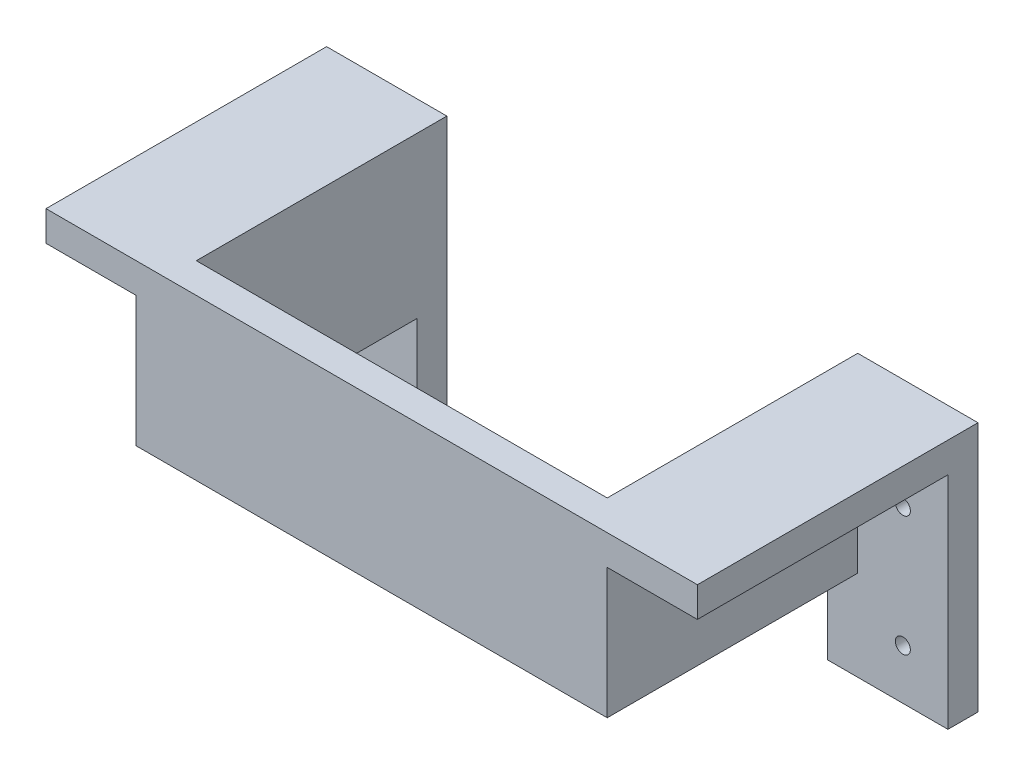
SolidWorks part; units mm, degrees
ref_plane "Plan de face" through (0, 0, 0) normal (0, 0, 1) x (1, 0, 0)
ref_plane "Plan de dessus" through (0, 0, 0) normal (0, 1, 0) x (1, 0, 0)
ref_plane "Plan de droite" through (0, 0, 0) normal (1, 0, 0) x (0, 0, -1)
sketch "Esquisse1" plane through (0, 0, 0) normal (0, 0, 1) x (1, 0, 0)
  line L1 (0, 0) -> (-65, 0)
  line L2 (0, 0) -> (0, -25)
  line L3 (0, -25) -> (-65, -25)
  line L4 (-65, 0) -> (-65, -25)
  dimension "D1" = 65
  dimension "D2" = 25
extrude "Boss.-Extru.1" add sketch "Esquisse1" along normal blind 3
sketch "Esquisse2" plane through (0, 0, 3) normal (0, 0, 1) x (1, 0, 0)
  line L0 (-65, 0) -> (-53, 0)
  line L1 (0, 0) -> (-65, 0) construction
  line L2 (-53, 0) -> (-53, -16)
  line L3 (-53, -16) -> (-56, -16)
  line L4 (-56, -16) -> (-56, -3)
  line L5 (-56, -3) -> (-65, -3)
  line L6 (-65, 0) -> (-65, -25) construction
  line L7 (-65, -3) -> (-65, 0)
  line L8 (-32.5, 0) -> (-32.5, -25) construction
  line L9 (-65, -25) -> (0, -25) construction
  line L10 (0, -3) -> (0, 0)
  line L11 (-9, -3) -> (0, -3)
  line L12 (-9, -16) -> (-9, -3)
  line L13 (-12, -16) -> (-9, -16)
  line L14 (-12, 0) -> (-12, -16)
  line L15 (0, 0) -> (-12, 0)
  dimension "D1" = 3
  dimension "D2" = 3
  dimension "D3" = 16
  dimension "D4" = 12
extrude "Boss.-Extru.2" add sketch "Esquisse2" along normal blind 25
sketch "Esquisse3" plane through (0, 0, 3) normal (0, 0, 1) x (1, 0, 0)
  line L0 (-60.5, -3) -> (-60.5, -25) construction
  line L1 (-65, -3) -> (-56, -3) construction
  line L2 (-65, -25) -> (0, -25) construction
  line L3 (-32.5, -25) -> (-32.5, 0) construction
  line L4 (-12, 0) -> (-53, 0) construction
  circle A0 centre (-60.5, -8) radius 0.75
  circle A1 centre (-60.5, -20) radius 0.75
  circle A2 centre (-4.5, -20) radius 0.75
  circle A3 centre (-4.5, -8) radius 0.75
extrude "Enlèv. mat.-Extru.1" cut sketch "Esquisse3" against normal through all
sketch "Esquisse4" plane through (0, 0, 3) normal (0, 0, 1) x (1, 0, 0)
  line L0 (-12, 0) -> (-12, -16) construction
  line L1 (-53, 0) -> (-12, 0)
  line L2 (-53, 0) -> (-53, -25)
  line L3 (-53, -25) -> (-12, -25)
  line L4 (-12, 0) -> (-12, -25)
  line L5 (-65, -25) -> (0, -25) construction
extrude "Enlèv. mat.-Extru.2" cut sketch "Esquisse4" against normal through all
sketch "Esquisse5" plane through (-53, 0, 0) normal (1, 0, 0) x (0, 0, -1)
  line L0 (-28, -16) -> (-3, -16) construction
  line L1 (-28, 0) -> (-25, 0)
  line L2 (-28, 0) -> (-28, -16)
  line L3 (-28, -16) -> (-25, -16)
  line L4 (-25, 0) -> (-25, -16)
  dimension "D1" = 3
extrude "Boss.-Extru.3" add sketch "Esquisse5" along normal up to next
equation "\"D2@Esquisse3\"=\"D1@Esquisse3\""
